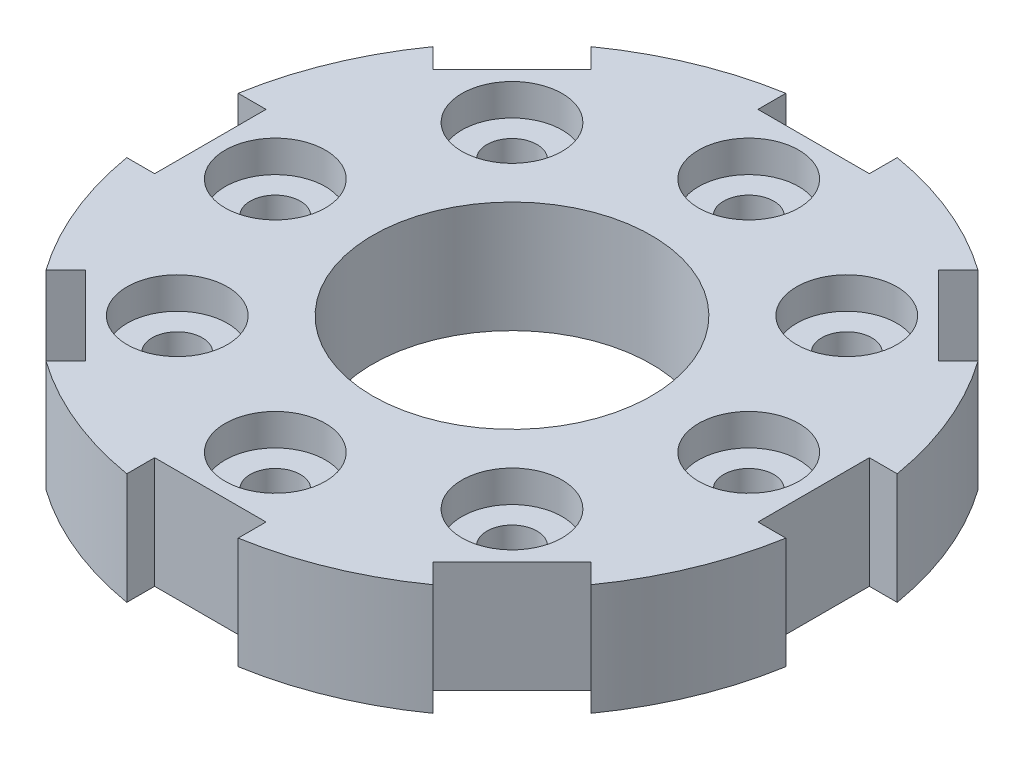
SolidWorks part; units mm, degrees
ref_plane "Front Plane" through (0, 0, 0) normal (0, 0, 1) x (1, 0, 0)
ref_plane "Top Plane" through (0, 0, 0) normal (0, 1, 0) x (1, 0, 0)
ref_plane "Right Plane" through (0, 0, 0) normal (1, 0, 0) x (0, 0, -1)
sketch "Sketch1" plane through (0, 0, 0) normal (0, 1, 0) x (1, 0, 0)
  circle A0 centre (0, 0) radius 60
  circle A1 centre (0, 0) radius 25
  dimension "D1" = 120
  dimension "D2" = 50
extrude "Extrude1" add sketch "Sketch1" along normal blind 20
hole_wizard "CBORE for M8 Hex Head Bolt1" positions "Sketch3" profile "Sketch2" counterbore size "M8" standard "Ansi Metric"
sketch "Sketch3" plane through (0, 20, 0) normal (0, 1, 0) x (-1, 0, 0)
  line L6 (-25, 0) -> (-60, 0) construction
  circle A7 centre (0, 0) radius 25 construction
  circle A8 centre (0, 0) radius 60 construction
  point P0 (-42.5, 0)
sketch "Sketch2" plane through (42.5, 20, 0) normal (1, 0, 0) x (0, 0, 1)
  line L0 (0, 0) -> (0, 20)
  line L1 (0, 20) -> (4.5, 20)
  line L3 (4.5, 20) -> (4.5, 5.68)
  line L4 (4.5, 5.68) -> (9.005, 5.68)
  line L5 (9.005, 5.68) -> (9.005, 0)
  line L7 (9.005, 0) -> (0, 0)
  line L11 (0, -6.35) -> (0, 107.95) construction
  dimension "Thru Hole Dia." = 9
  dimension "Thru Hole Depth" = 20
  dimension "C'Bore Dia." = 18.01
  dimension "C'Bore Depth" = 5.68
sketch "Sketch5" plane through (0, 20, 0) normal (0, 1, 0) x (-1, 0, 0)
  line L0 (0, 0) -> (-60, 0) construction
  line L1 (-54.1608, 10) -> (-59.1608, 10)
  line L2 (-54.1608, -10) -> (-59.1608, -10)
  line L3 (0, 10) -> (-66.3857, 10) construction
  line L5 (0, 0) -> (-66.3857, 0) construction
  line L6 (-54.1608, -10) -> (-54.1608, 10)
  circle A1 centre (0, 0) radius 60 construction
  arc A2 (-59.1608, 10) -> (-59.1608, -10) centre (0, 0) ccw
  point P10 (-54.1608, 0)
  dimension "D1" = 5
  dimension "D2" = 20
extrude "Cut-Extrude1" cut sketch "Sketch5" against normal through all
pattern_circular "CirPattern1" count 8 over 360 about axis through (0, 0, 0) along (0, 1, 0) of "CBORE for M8 Hex Head Bolt1", "Cut-Extrude1"
